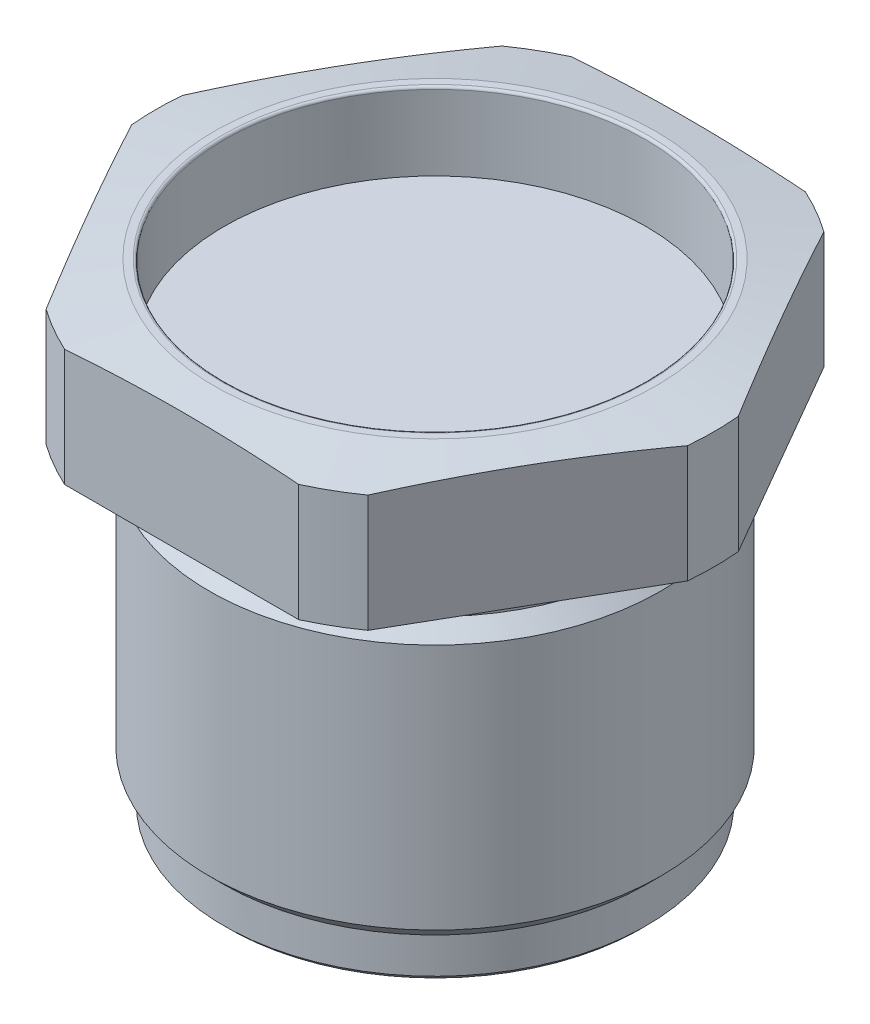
SolidWorks part; units mm, degrees
ref_plane "Front Plane" through (0, 0, 0) normal (0, 0, 1) x (1, 0, 0)
ref_plane "Top Plane" through (0, 0, 0) normal (0, 1, 0) x (1, 0, 0)
ref_plane "Right Plane" through (0, 0, 0) normal (1, 0, 0) x (0, 0, -1)
sketch "Sketch6" plane through (0, 0, 0) normal (0, 0, 1) x (1, 0, 0)
  line L0 (0, -8.9689) -> (0, 71.3762) construction
  line L1 (21.0185, 12.7) -> (21.9964, 12.7)
  line L2 (21.9964, 12.7) -> (27.813, 11.6744)
  line L3 (27.813, 11.6744) -> (27.813, 0)
  line L4 (27.813, 0) -> (21.0566, 0)
  line L5 (21.0566, 0) -> (21.0566, -34.8488)
  line L6 (21.0566, -34.8488) -> (0, -34.8488)
  line L7 (0, -34.8488) -> (0, 4.9784)
  line L8 (21.0185, 12.7) -> (21.0185, 4.9784)
  line L9 (21.0185, 4.9784) -> (0, 4.9784)
  dimension "D1" = 42.1132
  dimension "D2" = 12.7
  dimension "D3" = 34.8488
  dimension "D4" = 55.626
  dimension "D5" = 10
  dimension "D6" = 43.9928
  dimension "D7" = 7.7216
  dimension "D8" = 42.037
  dimension "D9" = 47.5488
revolve "Revolve3" add sketch "Sketch6" angle 360 about L0
fillet "Fillet7" radius 0.25 1 edges at (0, 12.7, -21.0185)
sketch "Sketch7" plane through (0, 0, 0) normal (0, -1, 0) x (1, 0, 0)
  line L0 (0, 0) -> (0, -52.3237) construction
  line L1 (-14.5781, 25.25) -> (14.5781, 25.25)
  line L2 (14.5781, 25.25) -> (29.1562, 0)
  line L3 (29.1562, 0) -> (14.5781, -25.25)
  line L4 (14.5781, -25.25) -> (-14.5781, -25.25)
  line L5 (-14.5781, -25.25) -> (-29.1562, 0)
  line L6 (-29.1562, 0) -> (-14.5781, 25.25)
  circle A0 centre (0, 0) radius 29.1562 construction
  dimension "D1" = 50.5
extrude "Cut-Extrude5" cut sketch "Sketch7" against normal through all flip side to cut
chamfer "Chamfer2" distance 0.5 angle 45 1 edges at (0, -34.8488, -21.0566)
sketch "Sketch8" plane through (0, 0, 0) normal (0, 0, 1) x (1, 0, 0)
  line L0 (-21.0566, -3.302) -> (-21.0566, -30.7848)
  line L1 (-21.0566, 0) -> (-21.0566, -34.3488) construction
  line L2 (-21.0566, -30.7848) -> (-22.5, -29.3414)
  line L3 (-22.5, -29.3414) -> (-22.5, -4.7454)
  line L4 (-22.5, -4.7454) -> (-21.0566, -3.302)
  line L5 (0, 0) -> (0, -34.3488) construction
  line L6 (-21.0566, -34.3488) -> (21.0566, -34.3488) construction
  line L7 (-20.5566, -34.8488) -> (20.5566, -34.8488) construction
  line L9 (-16.0362, 0) -> (-27.6981, 0) construction
  dimension "D1" = 45
  dimension "D2" = 45
  dimension "D3" = 4.064
  dimension "D4" = 3.302
revolve "Revolve4" add sketch "Sketch8" angle 360 about L5
fillet "Fillet8" radius 1.016 1 edges at (0, 0, -21.0566)
sketch "Sketch9" plane through (0, 0, 0) normal (0, 0, 1) x (1, 0, 0)
  line L0 (0, 0) -> (0, -34.8488) construction
  line L1 (-20.5566, -34.8488) -> (20.5566, -34.8488) construction
  line L2 (0, -34.8488) -> (0, -33.4772)
  line L3 (0, -33.4772) -> (7.5819, -33.4772)
  line L4 (7.5819, -33.4772) -> (7.5819, -34.8488)
  line L5 (7.5819, -34.8488) -> (0, -34.8488)
  line L6 (9.3853, -34.8488) -> (9.3853, -34.3154)
  line L7 (9.5631, -34.8488) -> (9.3853, -34.8488)
  line L8 (11.1633, -34.3154) -> (11.1633, -34.8488)
  line L9 (11.1633, -34.8488) -> (10.9855, -34.8488)
  line L10 (13.5636, -33.4772) -> (18.1864, -33.4772)
  line L12 (17.4398, -34.8488) -> (12.192, -34.8488)
  arc A0 (13.5636, -33.4772) -> (12.192, -34.8488) centre (13.5636, -34.8488) ccw
  arc A1 (18.1864, -33.4772) -> (17.4398, -34.8488) centre (18.1864, -34.3662) ccw
  arc A2 (9.3853, -34.3154) -> (9.5631, -34.8488) centre (10.2743, -34.3154) ccw
  arc A3 (10.9855, -34.8488) -> (11.1633, -34.3154) centre (10.2743, -34.3154) ccw
  point P14 (13.5636, -33.4772)
  dimension "D2" = 1.778
  dimension "D1" = 0.4826
  dimension "D3" = 36.3728
  dimension "D4" = 24.384
  dimension "D5" = 15.1638
  dimension "D6" = 20.5486
revolve "Cut-Revolve1" cut sketch "Sketch9" angle 360 about L0
sketch "Sketch10" plane through (0, 0, 0) normal (0, 0, 1) x (1, 0, 0)
  line L0 (-18.933, -34.798) -> (-17.4398, -34.798)
  line L2 (-11.0209, -34.798) -> (-9.5277, -34.798)
  line L3 (0, 0) -> (0, -34.798) construction
  arc A1 (-18.933, -34.798) -> (-17.4398, -34.798) centre (-18.1864, -34.3154) ccw
  arc A5 (-11.0209, -34.798) -> (-9.5277, -34.798) centre (-10.2743, -34.3154) ccw
revolve "Revolve6" add sketch "Sketch10" angle 360 about L3
